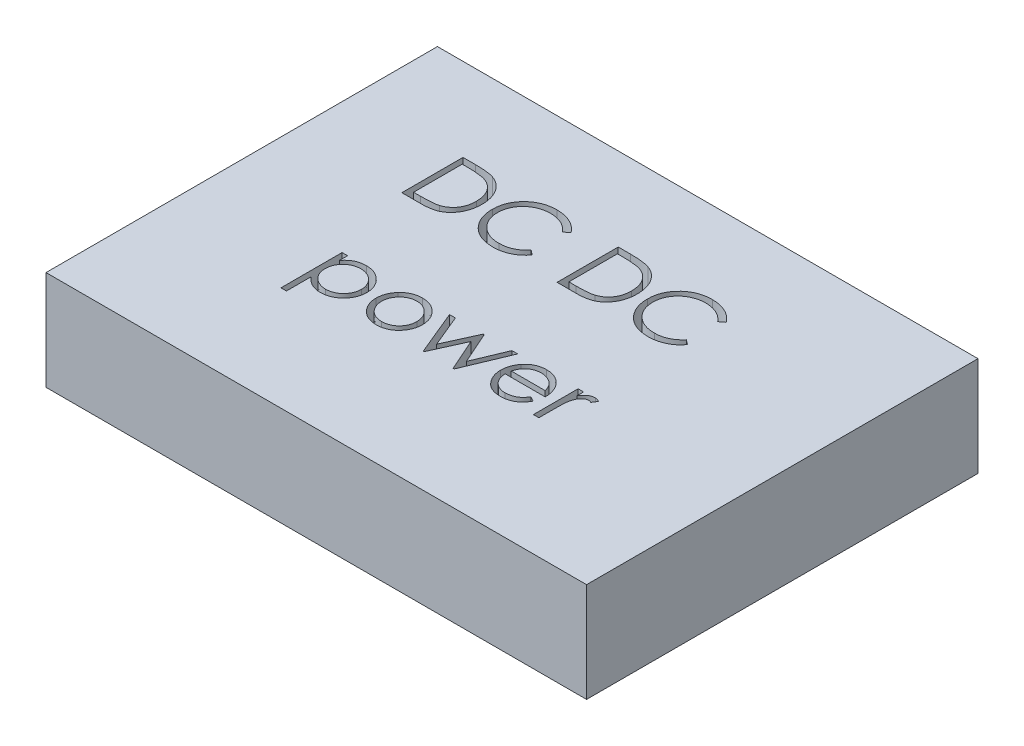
SolidWorks part; units mm, degrees
ref_plane "Front Plane" through (0, 0, 0) normal (0, 0, 1) x (1, 0, 0)
ref_plane "Top Plane" through (0, 0, 0) normal (0, 1, 0) x (1, 0, 0)
ref_plane "Right Plane" through (0, 0, 0) normal (1, 0, 0) x (0, 0, -1)
sketch "Sketch1" plane through (0, 0, 0) normal (0, 1, 0) x (1, 0, 0)
  line L1 (11.049, -8.001) -> (-11.049, -8.001)
  line L2 (11.049, -8.001) -> (11.049, 8.001)
  line L3 (11.049, 8.001) -> (-11.049, 8.001)
  line L4 (-11.049, -8.001) -> (-11.049, 8.001)
  line L5 (11.049, -8.001) -> (-11.049, 8.001) construction
  line L6 (11.049, 8.001) -> (-11.049, -8.001) construction
  point P0 (0, 0)
  dimension "D1" = 16.002
  dimension "D2" = 22.098
extrude "Boss-Extrude1" add sketch "Sketch1" along normal blind 4.064
sketch "Sketch2" plane through (0, 4.064, 0) normal (0, 1, 0) x (1, 0, 0)
  text T0 "DC DC   power" font "Century Gothic" height 2.5
extrude "Cut-Extrude1" cut sketch "Sketch2" against normal blind 1
